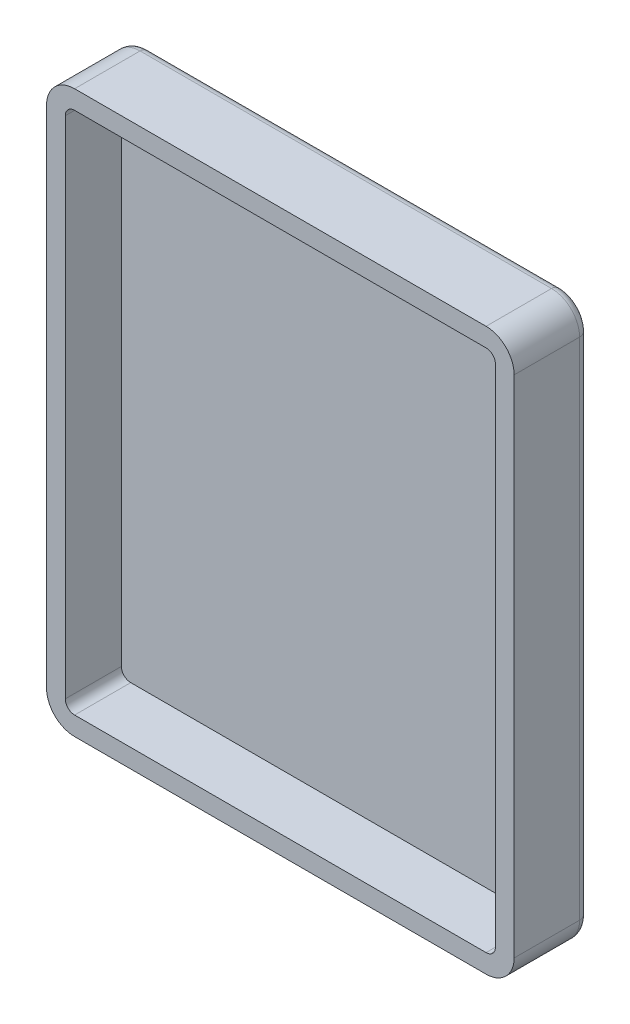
SolidWorks part; units mm, degrees
ref_plane "Front" through (0, 0, 0) normal (0, 0, 1) x (1, 0, 0)
ref_plane "Top" through (0, 0, 0) normal (0, 1, 0) x (1, 0, 0)
ref_plane "Right" through (0, 0, 0) normal (1, 0, 0) x (0, 0, -1)
sketch "Sketch1" plane through (0, 0, 0) normal (0, 0, 1) x (1, 0, 0)
  line L1 (0, 0) -> (50, 0)
  line L2 (0, 0) -> (0, 60)
  line L3 (0, 60) -> (50, 60)
  line L4 (50, 0) -> (50, 60)
  dimension "D1" = 50
  dimension "D2" = 60
extrude "Boss-Extrude1" add sketch "Sketch1" along normal blind 8
fillet "Fillet1" radius 3 4 edges at (50, 0, 4) (0, 0, 4) (0, 60, 4) (50, 60, 4)
shell "Shell1" thickness 4
fillet "Fillet4" radius 1 8 edges at (49.1213, 59.1213, 0) (25, 60, 0) (0.8787, 59.1213, 0) (0, 30, 0) (0.8787, 0.8787, 0) (25, 0, 0) (49.1213, 0.8787, 0) (50, 30, 0)
sketch "Sketch3" plane through (0, 0, 8) normal (0, 0, 1) x (1, 0, 0)
  line L4 (3, 0) -> (47, 0)
  line L5 (50, 3) -> (50, 57)
  line L6 (47, 60) -> (3, 60)
  line L7 (0, 57) -> (0, 3)
  line L8 (3, 0) -> (47, 0)
  line L9 (50, 3) -> (50, 57)
  line L10 (47, 60) -> (3, 60)
  line L11 (0, 57) -> (0, 3)
  line L20 (3, 2) -> (47, 2)
  line L21 (48, 3) -> (48, 57)
  line L22 (47, 58) -> (3, 58)
  line L23 (2, 57) -> (2, 3)
  line L24 (3, 2) -> (47, 2)
  line L25 (48, 3) -> (48, 57)
  line L26 (47, 58) -> (3, 58)
  line L27 (2, 57) -> (2, 3)
  arc A4 (47, 0) -> (50, 3) centre (47, 3) ccw
  arc A5 (50, 57) -> (47, 60) centre (47, 57) ccw
  arc A6 (3, 60) -> (0, 57) centre (3, 57) ccw
  arc A7 (0, 3) -> (3, 0) centre (3, 3) ccw
  arc A8 (47, 0) -> (50, 3) centre (47, 3) ccw
  arc A9 (50, 57) -> (47, 60) centre (47, 57) ccw
  arc A10 (3, 60) -> (0, 57) centre (3, 57) ccw
  arc A11 (0, 3) -> (3, 0) centre (3, 3) ccw
  arc A20 (47, 2) -> (48, 3) centre (47, 3) ccw
  arc A21 (48, 57) -> (47, 58) centre (47, 57) ccw
  arc A22 (3, 58) -> (2, 57) centre (3, 57) ccw
  arc A23 (2, 3) -> (3, 2) centre (3, 3) ccw
  arc A24 (47, 2) -> (48, 3) centre (47, 3) ccw
  arc A25 (48, 57) -> (47, 58) centre (47, 57) ccw
  arc A26 (3, 58) -> (2, 57) centre (3, 57) ccw
  arc A27 (2, 3) -> (3, 2) centre (3, 3) ccw
  dimension "D1" = 0
  dimension "D2" = 2
extrude "Cut-Extrude1" cut sketch "Sketch3" against normal blind 6 flip side to cut
